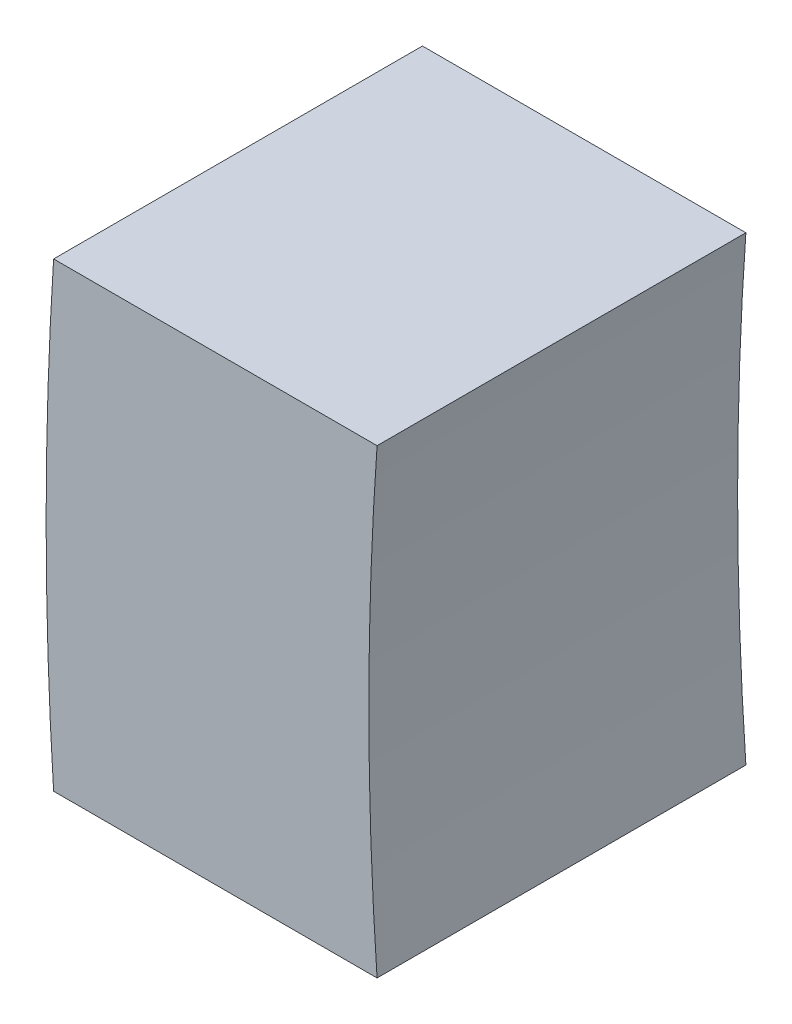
SolidWorks part; units mm, degrees
ref_plane "Plan de face" through (0, 0, 0) normal (0, 0, 1) x (1, 0, 0)
ref_plane "Plan de dessus" through (0, 0, 0) normal (0, 1, 0) x (1, 0, 0)
ref_plane "Plan de droite" through (0, 0, 0) normal (1, 0, 0) x (0, 0, -1)
sketch "Esquisse2" plane through (0, 0, 0) normal (0, 0, 1) x (1, 0, 0)
  line L0 (-76.8375, 5) -> (-69.8212, 5)
  line L1 (-76.8375, -5) -> (-69.8212, -5)
  arc A0 (-76.8375, 5) -> (-76.8375, -5) centre (0, 0) ccw
  arc A1 (-69.8212, 5) -> (-69.8212, -5) centre (0, 0) ccw
  dimension "D1" = 154
  dimension "D2" = 140
  dimension "D3" = 10
  dimension "D4" = 5
extrude "Extrusion1" add sketch "Esquisse2" along normal blind 8
